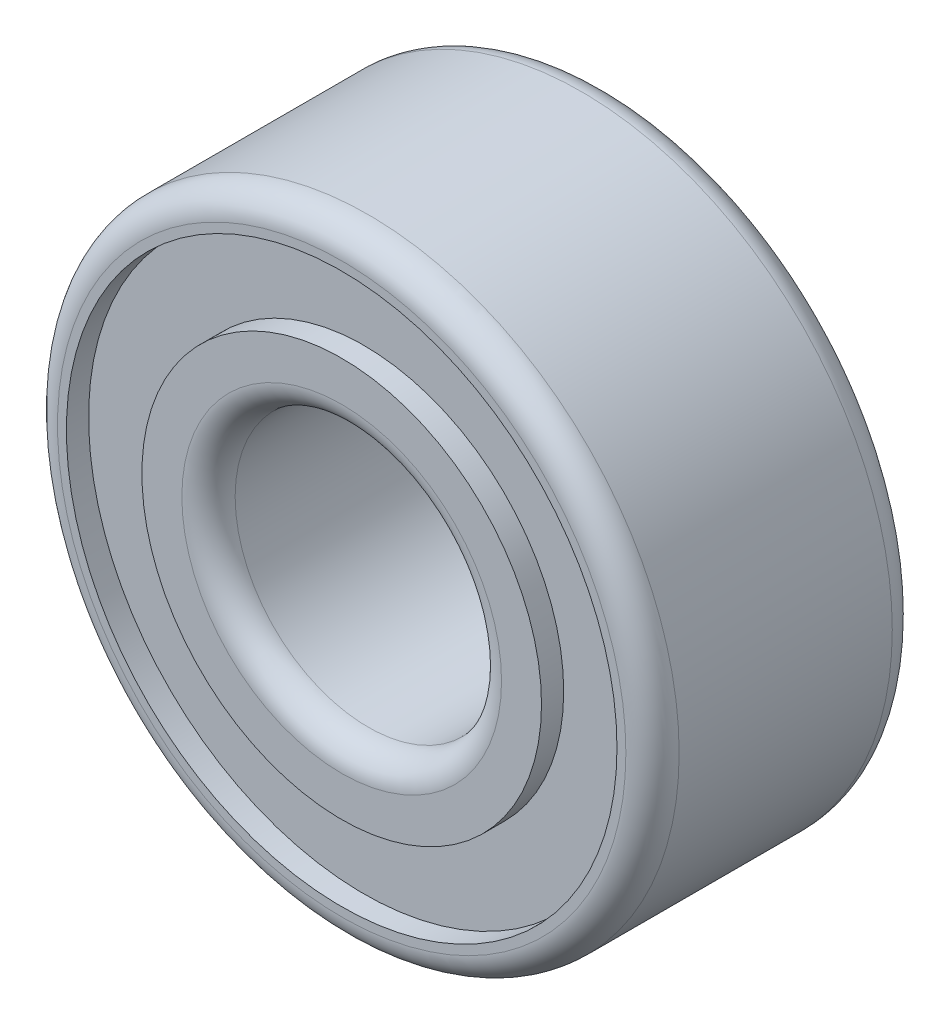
SolidWorks part; units mm, degrees
ref_plane "Face" through (0, 0, 0) normal (0, 0, 1) x (1, 0, 0)
ref_plane "Dessus" through (0, 0, 0) normal (0, 1, 0) x (1, 0, 0)
ref_plane "Droite" through (0, 0, 0) normal (1, 0, 0) x (0, 0, -1)
sketch "Esquisse1" plane through (0, 0, 0) normal (0, 0, 1) x (1, 0, 0)
  circle A0 centre (0, 0) radius 1.5
  circle A1 centre (0, 0) radius 3.5
  dimension "D1" = 3
  dimension "D2" = 7
extrude "Base-Extrusion" add sketch "Esquisse1" along normal mid plane 3
fillet "Congé1" radius 0.3
sketch "Esquisse2" plane through (0, 0, 1.5) normal (0, 0, 1) x (1, 0, 0)
  circle A1 centre (0, 0) radius 2.25
  circle A2 centre (0, 0) radius 3.1
  dimension "D1" = 4.5
  dimension "D2" = 6.2
extrude "Enlèv. mat.-Extru.1" cut sketch "Esquisse2" against normal blind 0.25
mirror "Symétrie1" about plane through (0, 0, 0) normal (0, 0, 1)
